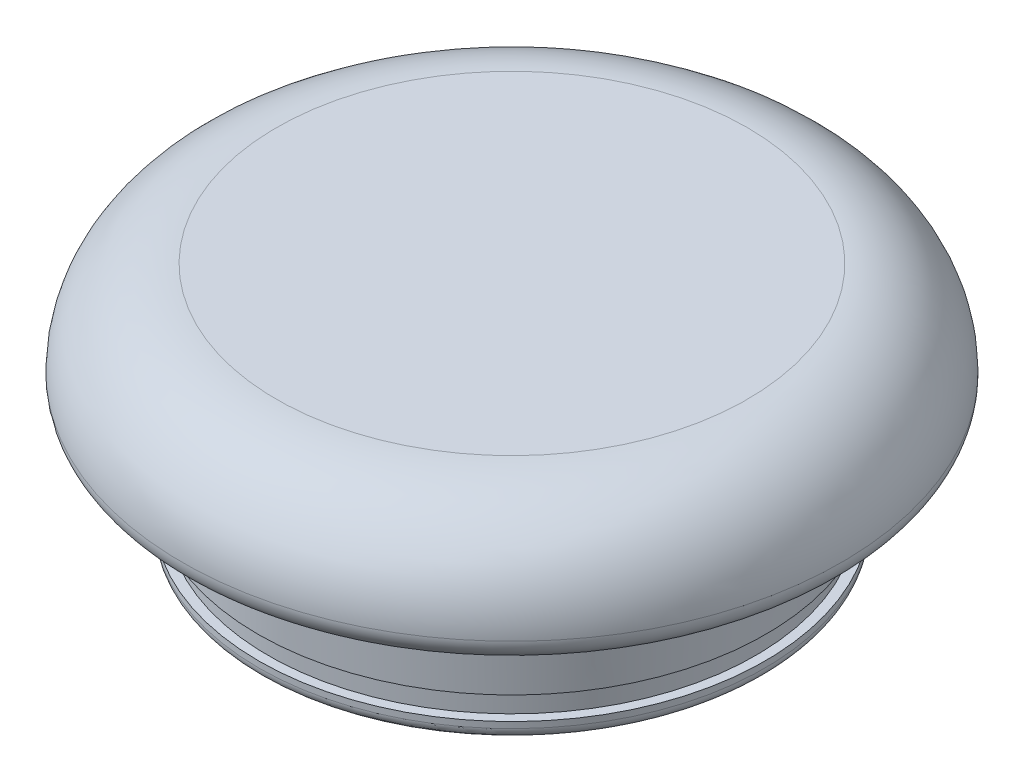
SolidWorks part; units mm, degrees
ref_plane "Front" through (0, 0, 0) normal (0, 0, 1) x (1, 0, 0)
ref_plane "Top" through (0, 0, 0) normal (0, 1, 0) x (1, 0, 0)
ref_plane "Right" through (0, 0, 0) normal (1, 0, 0) x (0, 0, -1)
sketch "Sketch1" plane through (0, 0, 0) normal (0, 0, 1) x (1, 0, 0)
  line L0 (0, -14.7475) -> (0, 17.9739) construction
  line L1 (-23.876, -25.4) -> (-23.1043, -3.302)
  line L2 (-23.1043, -3.302) -> (0, -3.302)
  line L3 (0, -3.302) -> (0, 0)
  line L4 (0, 0) -> (-25.4, 0)
  line L5 (-33.02, -12.7) -> (-27.686, -12.7)
  line L6 (-27.686, -12.7) -> (-27.3977, -20.955)
  line L7 (-26.2924, -23.495) -> (-27.309, -23.495)
  line L8 (-26.2924, -23.495) -> (-26.3811, -20.955)
  line L9 (-27.3977, -20.955) -> (-26.3811, -20.955)
  line L10 (-27.309, -23.495) -> (-27.2853, -24.1743)
  line L11 (-26.0161, -25.4) -> (-23.876, -25.4)
  arc A0 (-25.4, 0) -> (-35.56, -10.16) centre (-25.4, -10.16) ccw
  arc A1 (-35.56, -10.16) -> (-33.02, -12.7) centre (-33.02, -10.16) ccw
  arc A2 (-26.0161, -25.4) -> (-27.2853, -24.1743) centre (-26.0161, -24.13) cw
  dimension "D7" = 10.16
  dimension "D8" = 2.54
  dimension "D11" = 1.27
  dimension "D1" = 55.372
  dimension "D2" = 2
  dimension "D3" = 2
  dimension "D4" = 25.4
  dimension "D5" = 12.7
  dimension "D6" = 22.098
  dimension "D9" = 23.876
  dimension "D10" = 71.12
  dimension "D12" = 2.54
  dimension "D13" = 1.905
  dimension "D14" = 1.016
revolve "Base-Revolve" add sketch "Sketch1" angle 360 about L0
fillet "Fillet2" radius 0.635 2 edges at (0, -12.7, -27.686) (0, -3.302, -23.1043)
